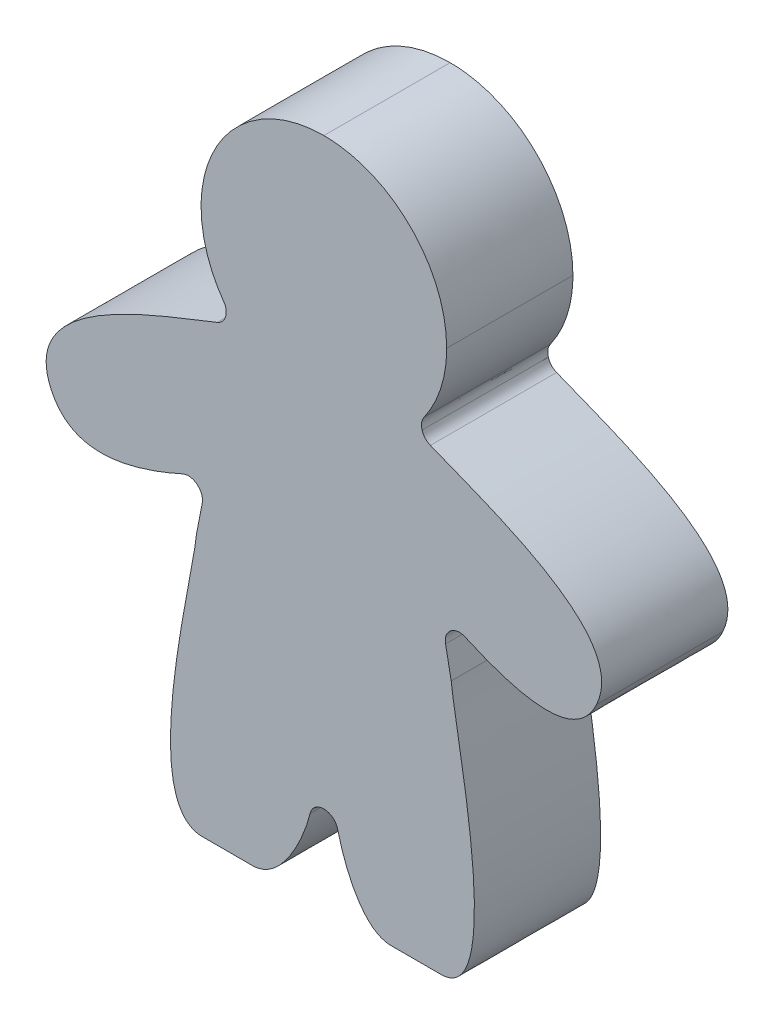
SolidWorks part; units mm, degrees
ref_plane "Front Plane" through (0, 0, 0) normal (0, 0, 1) x (1, 0, 0)
ref_plane "Top Plane" through (0, 0, 0) normal (0, 1, 0) x (1, 0, 0)
ref_plane "Right Plane" through (0, 0, 0) normal (1, 0, 0) x (0, 0, -1)
sketch "Sketch1" plane through (0, 0, 0) normal (0, 0, 1) x (1, 0, 0)
  spline S0 degree 3 poles (349.8107, 279.9483) (354.059, 278.2183) (362.414, 275.437) (360.3344, 270.9771) knots 0 0 0 0 0.037037 0.037037 0.037037 0.037037
  spline S1 degree 3 poles (360.3344, 270.9771) (359.0062, 268.1284) (355.4658, 268.9814) (352.0243, 270.5275) knots 0.037037 0.037037 0.037037 0.037037 0.074074 0.074074 0.074074 0.074074
  spline S2 degree 3 poles (352.0243, 270.5275) (351.7099, 270.6687) (351.3668, 270.626) (351.0966, 270.4121) knots 0.074074 0.074074 0.074074 0.074074 0.111111 0.111111 0.111111 0.111111
  spline S3 degree 3 poles (351.0966, 270.4121) (350.8265, 270.1981) (350.7064, 269.8739) (350.7718, 269.5356) knots 0.111111 0.111111 0.111111 0.111111 0.148148 0.148148 0.148148 0.148148
  spline S4 degree 2 poles (350.7718, 269.5356) (350.7718, 269.5356) (351.1302, 267.6838) knots 0.148148 0.148148 0.148148 0.185185 0.185185 0.185185
  spline S5 degree 3 poles (351.1302, 267.6838) (351.3558, 265.1052) (354.6979, 251.2466) (350.4788, 251.2466) knots 0.185185 0.185185 0.185185 0.185185 0.222222 0.222222 0.222222 0.222222
  spline S6 degree 2 poles (350.4788, 251.2466) (350.4788, 251.2466) (347.3219, 251.2466) knots 0.222222 0.222222 0.222222 0.259259 0.259259 0.259259
  spline S7 degree 3 poles (347.3219, 251.2466) (345.4085, 251.2466) (344.2847, 254.4389) (343.937, 255.9248) knots 0.259259 0.259259 0.259259 0.259259 0.296296 0.296296 0.296296 0.296296
  spline S8 degree 3 poles (343.937, 255.9248) (343.8408, 256.3361) (343.4839, 256.6196) (343.0609, 256.6196) knots 0.296296 0.296296 0.296296 0.296296 0.333333 0.333333 0.333333 0.333333
  spline S9 degree 3 poles (343.0609, 256.6196) (342.6378, 256.6195) (342.281, 256.336) (342.1848, 255.9248) knots 0.333333 0.333333 0.333333 0.333333 0.37037 0.37037 0.37037 0.37037
  spline S10 degree 3 poles (342.1848, 255.9248) (341.8372, 254.4389) (340.4432, 251.2466) (338.5298, 251.2466) knots 0.37037 0.37037 0.37037 0.37037 0.407407 0.407407 0.407407 0.407407
  spline S11 degree 2 poles (338.5298, 251.2466) (338.5298, 251.2466) (335.3731, 251.2466) knots 0.407407 0.407407 0.407407 0.444444 0.444444 0.444444
  spline S12 degree 3 poles (335.3731, 251.2466) (331.1543, 251.2466) (334.7661, 265.1052) (334.9918, 267.6838) knots 0.444444 0.444444 0.444444 0.444444 0.481481 0.481481 0.481481 0.481481
  spline S13 degree 2 poles (334.9918, 267.6838) (334.9918, 267.6838) (335.3501, 269.5357) knots 0.481481 0.481481 0.481481 0.518519 0.518519 0.518519
  spline S14 degree 3 poles (335.3501, 269.5357) (335.4156, 269.874) (335.2955, 270.1982) (335.0253, 270.4122) knots 0.518519 0.518519 0.518519 0.518519 0.555556 0.555556 0.555556 0.555556
  spline S15 degree 3 poles (335.0253, 270.4122) (334.7552, 270.6261) (334.4121, 270.6688) (334.0977, 270.5276) knots 0.555556 0.555556 0.555556 0.555556 0.592593 0.592593 0.592593 0.592593
  spline S16 degree 3 poles (334.0977, 270.5276) (330.6562, 268.9814) (327.1158, 268.1285) (325.7875, 270.9772) knots 0.592593 0.592593 0.592593 0.592593 0.62963 0.62963 0.62963 0.62963
  spline S17 degree 3 poles (325.7875, 270.9772) (323.7078, 275.437) (332.0628, 278.2182) (336.3112, 279.9482) knots 0.62963 0.62963 0.62963 0.62963 0.666667 0.666667 0.666667 0.666667
  spline S18 degree 3 poles (336.3112, 279.9482) (336.5742, 280.0554) (336.756, 280.257) (336.8355, 280.5297) knots 0.666667 0.666667 0.666667 0.666667 0.703704 0.703704 0.703704 0.703704
  spline S19 degree 3 poles (336.8355, 280.5297) (336.9151, 280.8024) (336.8702, 281.0702) (336.706, 281.3019) knots 0.703704 0.703704 0.703704 0.703704 0.740741 0.740741 0.740741 0.740741
  spline S20 degree 3 poles (336.706, 281.3019) (335.8073, 282.5709) (335.2791, 284.1209) (335.2791, 285.7943) knots 0.740741 0.740741 0.740741 0.740741 0.777778 0.777778 0.777778 0.777778
  spline S21 degree 3 poles (335.2791, 285.7943) (335.2791, 290.092) (338.7631, 293.5761) (343.0609, 293.5761) knots 0.777778 0.777778 0.777778 0.777778 0.814815 0.814815 0.814815 0.814815
  spline S22 degree 3 poles (343.0609, 293.5761) (347.3587, 293.5761) (350.8427, 290.092) (350.8427, 285.7943) knots 0.814815 0.814815 0.814815 0.814815 0.851852 0.851852 0.851852 0.851852
  spline S23 degree 3 poles (350.8427, 285.7943) (350.8427, 284.121) (350.3145, 282.5709) (349.4159, 281.3019) knots 0.851852 0.851852 0.851852 0.851852 0.888889 0.888889 0.888889 0.888889
  spline S24 degree 3 poles (349.4159, 281.3019) (349.2517, 281.0702) (349.2068, 280.8024) (349.2864, 280.5297) knots 0.888889 0.888889 0.888889 0.888889 0.925926 0.925926 0.925926 0.925926
  spline S25 degree 3 poles (349.2864, 280.5297) (349.3659, 280.2571) (349.5477, 280.0555) (349.8107, 279.9483) knots 0.925926 0.925926 0.925926 0.925926 1 1 1 1
extrude "Boss-Extrude1" add sketch "Sketch1" along normal blind 8
